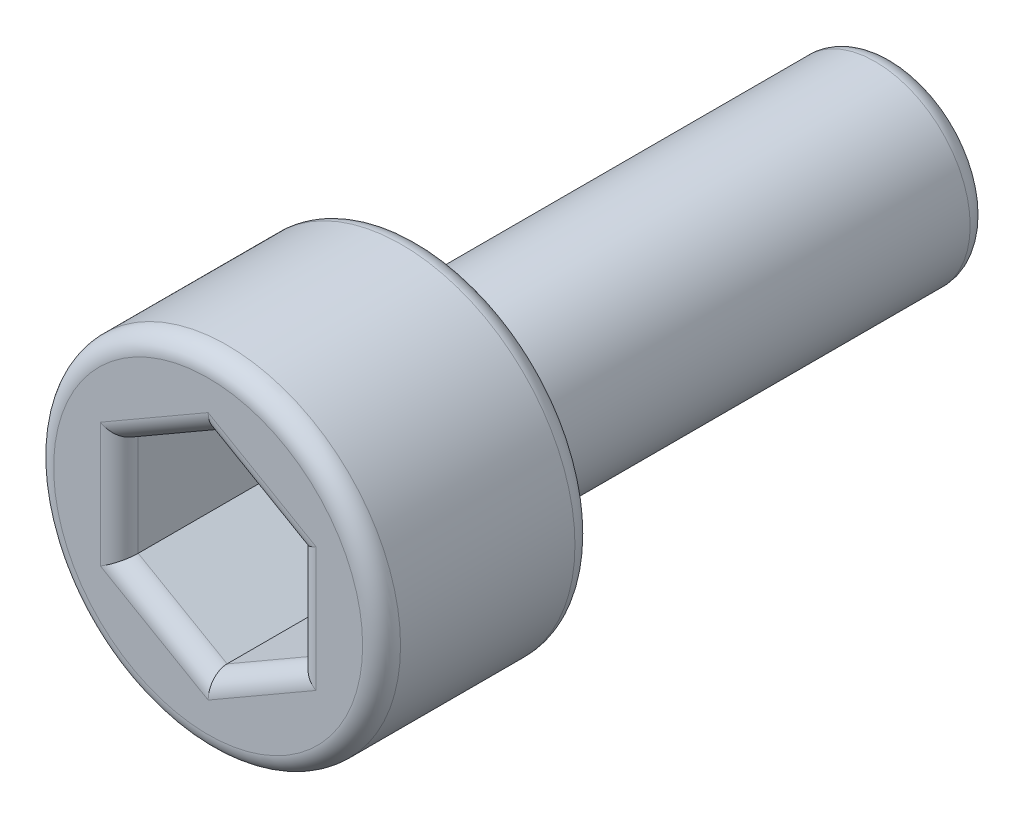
SolidWorks part; units mm, degrees
ref_plane "Front Plane" through (0, 0, 0) normal (0, 0, 1) x (1, 0, 0)
ref_plane "Top Plane" through (0, 0, 0) normal (0, 1, 0) x (1, 0, 0)
ref_plane "Right Plane" through (0, 0, 0) normal (1, 0, 0) x (0, 0, -1)
sketch "Sketch1" plane through (0, 0, 0) normal (0, 0, 1) x (1, 0, 0)
  circle A0 centre (0, 0) radius 1.27
  dimension "D1" = 2.54
extrude "Extrude1" add sketch "Sketch1" along normal blind 6.35
sketch "Sketch2" plane through (0, 0, 6.35) normal (0, 0, 1) x (1, 0, 0)
  circle A0 centre (0, 0) radius 2.3241
  dimension "D1" = 4.6482
extrude "Extrude2" add sketch "Sketch2" along normal blind 2.8448
sketch "Sketch3" plane through (0, 0, 9.1948) normal (0, 0, 1) x (1, 0, 0)
  line L1 (0, -1.3748) -> (1.1906, -0.6874)
  line L2 (1.1906, -0.6874) -> (1.1906, 0.6874)
  line L3 (1.1906, 0.6874) -> (0, 1.3748)
  line L4 (0, 1.3748) -> (-1.1906, 0.6874)
  line L5 (-1.1906, 0.6874) -> (-1.1906, -0.6874)
  line L6 (-1.1906, -0.6874) -> (0, -1.3748)
  circle A0 centre (0, 0) radius 1.1906 construction
  dimension "D1" = 2.3813
extrude "Cut-Extrude1" cut sketch "Sketch3" against normal blind 2.032
fillet "Fillet1" radius 0.254 6 edges at (-0.5953, -1.0311, 9.1948) (0.5953, -1.0311, 9.1948) (1.1906, 0, 9.1948) (0.5953, 1.0311, 9.1948) (-0.5953, 1.0311, 9.1948) (-1.1906, 0, 9.1948)
fillet "Fillet2" radius 0.254 2 edges at (2.3241, 0, 6.35) (2.3241, 0, 9.1948)
fillet "Fillet3" radius 0.254 1 edges at (1.27, 0, 0)
